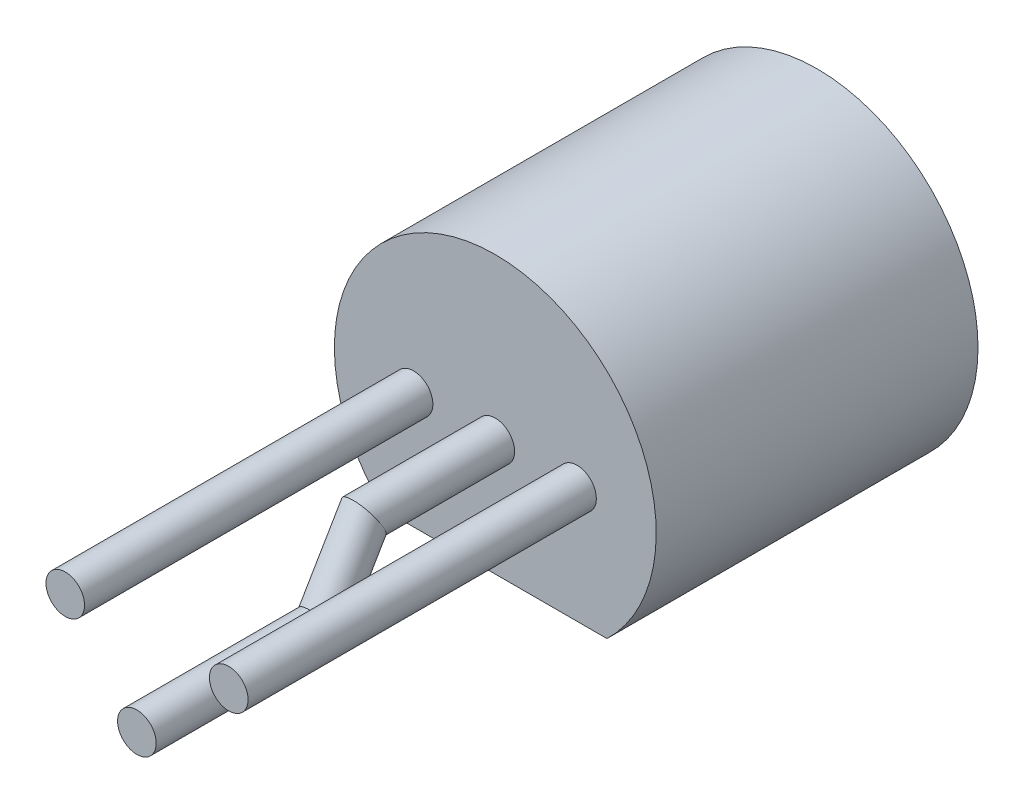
SolidWorks part; units mm, degrees
ref_plane "Plan1" through (0, 0, 0) normal (0, 0, 1) x (1, 0, 0)
ref_plane "Plan2" through (0, 0, 0) normal (0, 1, 0) x (1, 0, 0)
ref_plane "Plan3" through (0, 0, 0) normal (1, 0, 0) x (0, 0, -1)
sketch "Esquisse1" plane through (0, 0, 0) normal (0, 0, 1) x (1, 0, 0)
  line L0 (-1.7349, -1.8) -> (1.7349, -1.8)
  arc A0 (1.7349, -1.8) -> (-1.7349, -1.8) centre (0, 0) ccw
  dimension "D1" = 5
  dimension "D2" = 1.8
extrude "Base-Extrusion" add sketch "Esquisse1" along normal blind 5
sketch "Esquisse2" plane through (0, 0, 5) normal (0, 0, 1) x (1, 0, 0)
  circle A0 centre (-1.27, 0) radius 0.3
sketch "Esquisse3" plane through (0, 0, 0) normal (0, 1, 0) x (1, 0, 0)
  line L0 (-1.27, -5) -> (-1.27, -10.4114)
sweep "Boss.-Balayage1" add profiles "Esquisse2" path "Esquisse3"
mirror "Symétrie1" about plane through (0, 0, 0) normal (1, 0, 0) of "Boss.-Balayage1"
sketch "Esquisse4" plane through (0, 0, 5) normal (0, 0, 1) x (1, 0, 0)
  circle A0 centre (0, 0) radius 0.3
  circle A1 centre (1.27, 0) radius 0.3 construction
sketch "Esquisse6" plane through (0, 0, 0) normal (1, 0, 0) x (0, 0, -1)
  line L0 (-5, 0) -> (-7.0395, 0)
  line L1 (-7.0395, 0) -> (-7.7113, -1.1424)
  line L2 (-7.7113, -1.1424) -> (-10.569, -1.1424)
sweep "Balayage1" add profiles "Esquisse4" path "Esquisse6"
